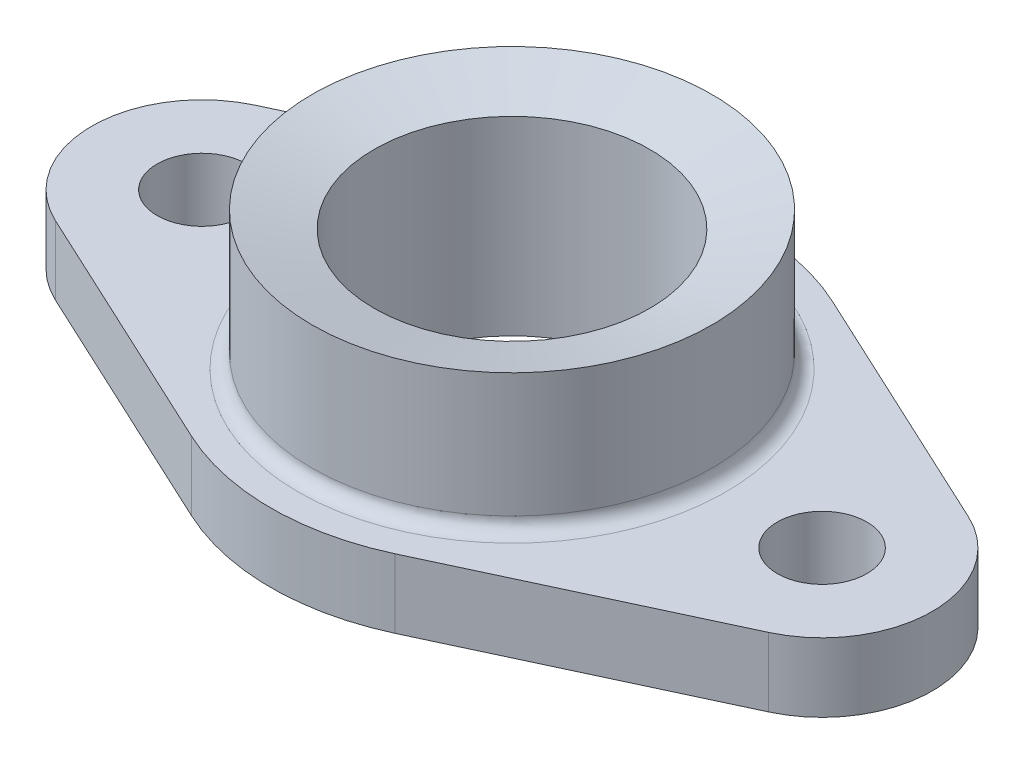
SolidWorks part; units mm, degrees
ref_plane "正面" through (0, 0, 0) normal (0, 0, 1) x (1, 0, 0)
ref_plane "平面" through (0, 0, 0) normal (0, 1, 0) x (1, 0, 0)
ref_plane "右側面" through (0, 0, 0) normal (1, 0, 0) x (0, 0, -1)
sketch "ｽｹｯﾁ1" plane through (0, 0, 0) normal (0, 1, 0) x (1, 0, 0)
  line L0 (-45, 0) -> (45, 0) construction
  circle A0 centre (-45, 0) radius 6.5
  circle A1 centre (45, 0) radius 6.5
  circle A2 centre (0, 0) radius 20
  circle A3 centre (0, 0) radius 29
  dimension "D2" = 13
  dimension "D3" = 58
  dimension "D4" = 40
  dimension "D1" = 90
sketch "ｽｹｯﾁ2" plane through (0, 0, 0) normal (0, 1, 0) x (1, 0, 0)
  line L0 (-45, 0) -> (45, 0) construction
  circle A0 centre (-45, 0) radius 16
  circle A1 centre (45, 0) radius 16
  circle A2 centre (0, 0) radius 35
  dimension "D1" = 32
  dimension "D2" = 70
sketch "ｽｹｯﾁ3" plane through (0, 0, 0) normal (0, 1, 0) x (1, 0, 0)
  line L0 (-51.7556, 14.5039) -> (-14.7778, 31.7272)
  line L1 (-14.7778, -31.7272) -> (-51.7556, -14.5039)
  line L2 (14.7778, 31.7272) -> (51.7556, 14.5039)
  line L3 (51.7556, -14.5039) -> (14.7778, -31.7272)
  circle A0 centre (45, 0) radius 16 construction
  circle A1 centre (0, 0) radius 35 construction
  circle A2 centre (-45, 0) radius 16 construction
  arc A3 (51.7556, -14.5039) -> (51.7556, 14.5039) centre (45, 0) ccw
  arc A4 (-14.7778, -31.7272) -> (14.7778, -31.7272) centre (0, 0) ccw
  arc A5 (-51.7556, 14.5039) -> (-51.7556, -14.5039) centre (-45, 0) ccw
  arc A6 (14.7778, 31.7272) -> (-14.7778, 31.7272) centre (0, 0) ccw
extrude "押し出し1" add sketch "ｽｹｯﾁ3" along normal blind 10
sketch "ｽｹｯﾁ4" plane through (0, 0, 0) normal (0, 1, 0) x (1, 0, 0)
  circle A0 centre (0, 0) radius 29 construction
  circle A1 centre (0, 0) radius 29
extrude "押し出し2" add sketch "ｽｹｯﾁ4" along normal blind 30
sketch "ｽｹｯﾁ5" plane through (0, 0, 0) normal (0, 1, 0) x (1, 0, 0)
  circle A0 centre (0, 0) radius 20 construction
  circle A1 centre (0, 0) radius 20
extrude "ｶｯﾄ - 押し出し1" cut sketch "ｽｹｯﾁ5" along normal through all
sketch "ｽｹｯﾁ6" plane through (0, 0, 0) normal (0, 1, 0) x (1, 0, 0)
  circle A0 centre (45, 0) radius 6.5 construction
  circle A1 centre (-45, 0) radius 6.5 construction
  circle A2 centre (45, 0) radius 6.5
  circle A3 centre (-45, 0) radius 6.5
extrude "ｶｯﾄ - 押し出し2" cut sketch "ｽｹｯﾁ6" along normal through all
chamfer "面取り1" distance 9 angle 15 1 edges at (0, 30, 20)
fillet "ﾌｨﾚｯﾄ1" radius 2 1 edges at (0, 10, 29)
